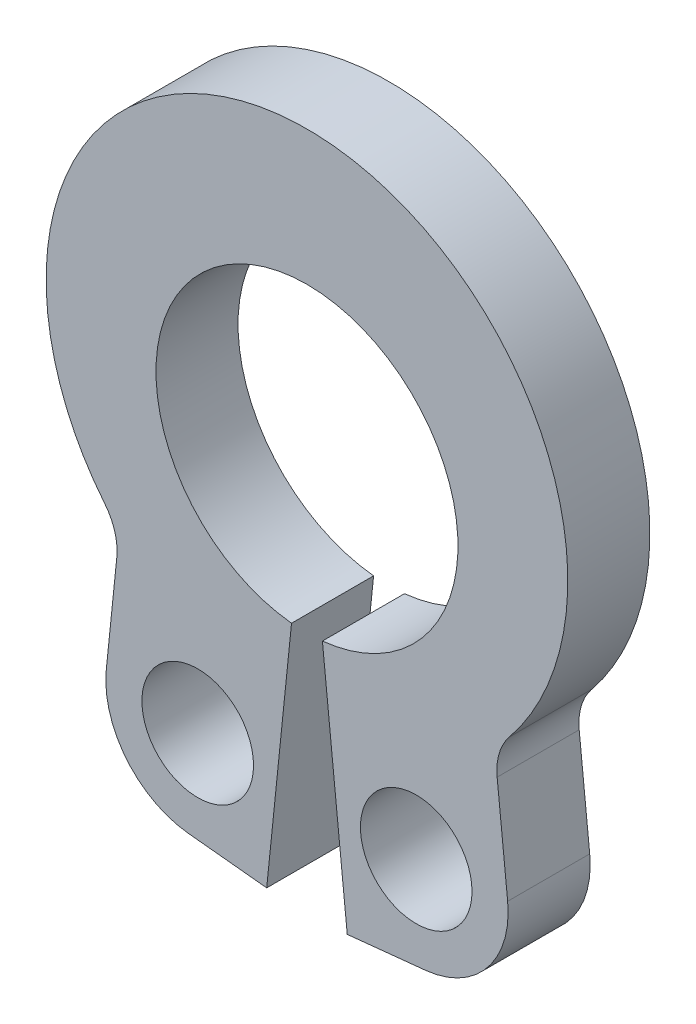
SolidWorks part; units mm, degrees
extrude "Body" add sketch "BodySke" against normal blind 0.635
sketch "BodySke" plane through (0, 0, 0) normal (0, 0, 1) x (1, 0, 0)
  line L0 (-1.5431, 0) -> (1.5431, 0) construction
  line L1 (0, 0) -> (0, 2.2098) construction
  line L2 (0.1195, -1.1623) -> (0.3117, -3.032)
  line L3 (-0.1195, -1.1623) -> (-0.3117, -3.032)
  line L4 (0, 0) -> (1.3282, -1.3282) construction
  line L5 (0, 0) -> (-1.3282, -1.3282) construction
  line L6 (0.3117, -3.032) -> (0.9181, -2.9697)
  line L7 (-0.3117, -3.032) -> (-0.9181, -2.9697)
  line L9 (1.4715, -1.3983) -> (1.5528, -2.1895)
  line L14 (-1.4715, -1.3983) -> (-1.5528, -2.1895)
  circle A0 centre (0, 0) radius 1.1684 construction
  arc A1 (0.1195, -1.1623) -> (-0.1195, -1.1623) centre (0, 0) ccw
  arc A2 (1.3282, -1.3282) -> (-1.3282, -1.3282) centre (0, 0.1915) ccw construction
  arc A3 (-1.5528, -2.1895) -> (-0.9181, -2.9697) centre (-0.8454, -2.2622) ccw
  arc A4 (-1.4715, -1.3983) -> (-1.566, -1.0817) centre (-1.901, -1.3541) ccw
  arc A5 (1.566, -1.0817) -> (1.4715, -1.3983) centre (1.901, -1.3541) ccw
  arc A6 (0.9181, -2.9697) -> (1.5528, -2.1895) centre (0.8454, -2.2622) ccw
  arc A7 (1.566, -1.0817) -> (-1.566, -1.0817) centre (0, 0.1915) ccw
ref_plane "Plane1" through (0, 0, 0) normal (0, 0, 1) x (1, 0, 0)
ref_plane "Plane2" through (0, 0, 0) normal (0, 1, 0) x (1, 0, 0)
ref_plane "Plane3" through (0, 0, 0) normal (1, 0, 0) x (0, 0, -1)
other "Configuration Table"
sketch "Clipboard" plane through (0, 0, 0) normal (0, 0, 1) x (1, 0, 0)
  line L0 (0, 0) -> (1.7272, 0)
  line L1 (0, 0) -> (0, 5.2578)
  line L2 (0, 0) -> (0, -1.8796)
  line L3 (0, 0) -> (-1.016, 0)
  circle A0 centre (0, 0) radius 0.4318
  circle A1 centre (0, 0) radius 1.1684
  circle A2 centre (0, 0) radius 1.1303
sketch "HolSke" plane through (0, 0, 0) normal (0, 0, 1) x (1, 0, 0)
  line L0 (0, 0) -> (0, -2.9285) construction
  line L1 (0.3117, -3.032) -> (0.9181, -2.9697) construction
  line L2 (0.1195, -1.1623) -> (0.3117, -3.032) construction
  circle A0 centre (0.8454, -2.2622) radius 0.4318
  circle A1 centre (-0.8454, -2.2622) radius 0.4318
extrude "Holes" cut sketch "HolSke" against normal through all
sketch "NotSke" plane through (0, 0, 0) normal (0, 0, 1) x (1, 0, 0)
  line L2 (0, 0) -> (0, -3.0231) construction
  arc A0 (0.5202, -2.4862) -> (0.3434, -1.6409) centre (0.4318, -2.0635) ccw
  arc A1 (-0.3434, -1.6409) -> (-0.5202, -2.4862) centre (-0.4318, -2.0635) ccw
  arc A2 (-0.8432, -1.9322) -> (0.8432, -1.9322) centre (0, 0) ccw construction
  arc A3 (0.1195, -1.1623) -> (-0.1195, -1.1623) centre (0, 0) ccw construction
  circle A4 centre (0.4318, -2.0635) radius 0.4318 construction
  circle A5 centre (-0.4318, -2.0635) radius 0.4318 construction
  arc A6 (-0.3434, -1.6409) -> (0.3434, -1.6409) centre (0, 0) ccw
  arc A7 (-0.5202, -2.4862) -> (0.5202, -2.4862) centre (0, 0) ccw
extrude "Notch" [suppressed] cut sketch "NotSke" against normal through all
fillet "NotchFillets" [suppressed] radius 0.2478
equation "' \"ShaftDia@Clipboard\" = 0.058"
equation "' \"FreeDia@Clipboard\" = 0.055"
equation "' \"Thickness@Body\" = 0.015"
equation "' \"GrooveDia@BodySke\" = 0.058"
equation "' \"LugSection@Clipboard\" = 0.066"
equation "' \"RingHeight@Clipboard\" = 0.145"
equation "' \"HoleDia@Clipboard\" = 0.035"
equation "' \"LugBasis@Clipboard\" = 0.03"
equation "' \"ShaftDia@Clipboard\" = 0.092"
equation "' \"FreeDia@Clipboard\" = 0.089"
equation "' \"Thickness@Body\" = 0.025"
equation "' \"GrooveDia@BodySke\" = 0.092"
equation "' \"LugSection@Clipboard\" = 0.074"
equation "' \"RingHeight@Clipboard\" = 0.207"
equation "' \"HoleDia@Clipboard\" = 0.034"
equation "' \"LugBasis@Clipboard\" = 0.04"
equation "\"LargeRad@BodySke\" =  \"RingHeight@Clipboard\" - \"GrooveDia@BodySke\" / 2  - \"LugSection@Clipboard\""
equation "\"SmallRad@BodySke\" = \"LargeRad@BodySke\" * 0.85"
equation "\"LugY@BodySke\" =  \"GrooveDia@BodySke\" / 2 +  \"LugSection@Clipboard\" "
equation "\"GapAng@BodySke\" = 360 - 360 * (\"FreeDia@Clipboard\" /  \"GrooveDia@BodySke\" )"
equation "\"HoleDia@NotSke\" = \"HoleDia@Clipboard\""
equation "\"NotchRad@NotSke\" = \"LugY@BodySke\" - \"LugSection@Clipboard\" / 2"
equation "\"Radius@NotchFillets\" = (\"LugSection@Clipboard\" - \"HoleDia@Clipboard\" ) / 4.1"
equation "\"LugWidth@BodySke\" = \"LugBasis@Clipboard\"  * 1.3"
equation "\"LugFilletRad@BodySke\" = \"LugBasis@Clipboard\"  * 0.7"
equation "\"BodyFilletRad@BodySke\" = \"HoleDia@Clipboard\" / 2"
equation "\"HoleOffset@HolSke\" =  \"LugBasis@Clipboard\"  * 0.6"
equation "\"HoleInset@HolSke\" = \"LugBasis@Clipboard\"  * 0.7"
equation "\"HoleDia@HolSke\" = \"HoleDia@Clipboard\""
